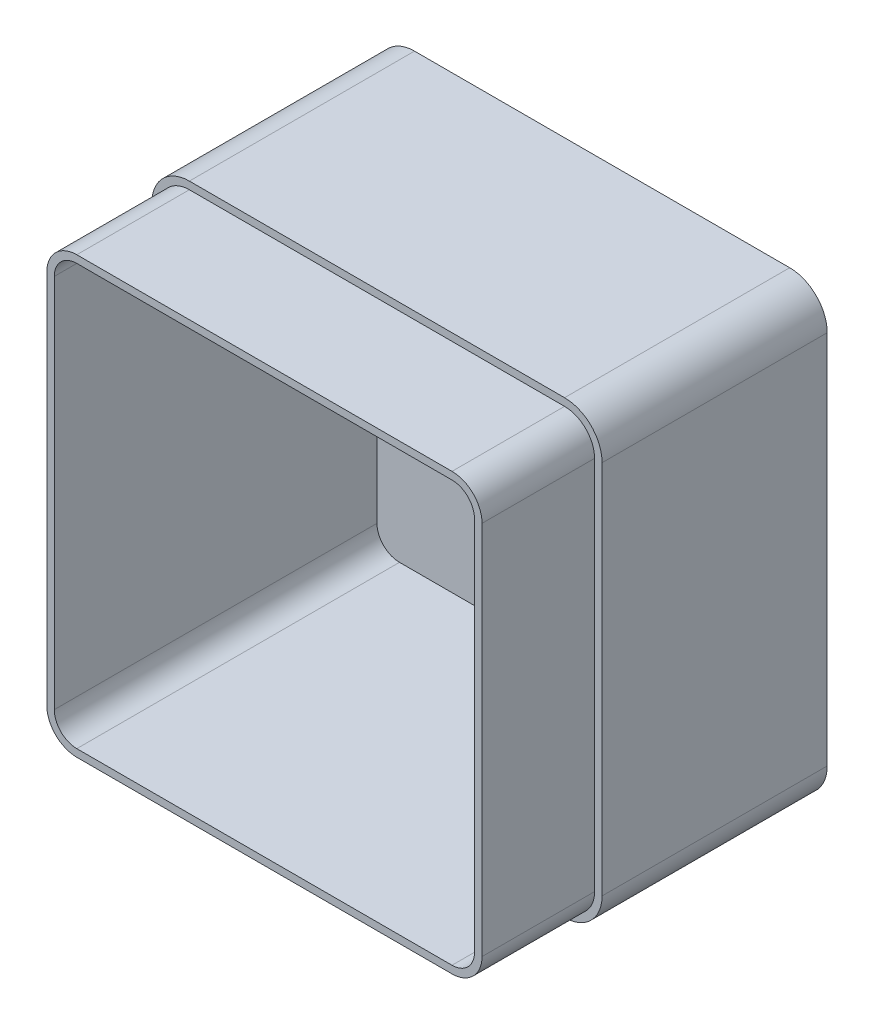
SolidWorks part; units mm, degrees
ref_plane "Front Plane" through (0, 0, 0) normal (0, 0, 1) x (1, 0, 0)
ref_plane "Top Plane" through (0, 0, 0) normal (0, 1, 0) x (1, 0, 0)
ref_plane "Right Plane" through (0, 0, 0) normal (1, 0, 0) x (0, 0, -1)
sketch "Sketch1" plane through (0, 0, 0) normal (0, 0, 1) x (1, 0, 0)
  line L1 (0, 0) -> (120, 0)
  line L2 (0, 0) -> (0, 120)
  line L3 (0, 120) -> (120, 120)
  line L4 (120, 0) -> (120, 120)
  dimension "D1" = 120
  dimension "D2" = 120
extrude "Extrude1" add sketch "Sketch1" along normal blind 90
fillet "Fillet1" radius 10 4 edges at (120, 0, 45) (120, 120, 45) (0, 120, 45) (0, 0, 45)
shell "Shell1" thickness 4
sketch "Sketch2" plane through (0, 0, 90) normal (0, 0, 1) x (1, 0, 0)
  line L4 (10, 0) -> (110, 0)
  line L5 (120, 10) -> (120, 110)
  line L6 (110, 120) -> (10, 120)
  line L7 (0, 110) -> (0, 10)
  line L8 (10, 0) -> (110, 0)
  line L9 (120, 10) -> (120, 110)
  line L10 (110, 120) -> (10, 120)
  line L11 (0, 110) -> (0, 10)
  line L16 (10, 2) -> (110, 2)
  line L17 (118, 10) -> (118, 110)
  line L18 (110, 118) -> (10, 118)
  line L19 (2, 110) -> (2, 10)
  line L20 (10, 2) -> (110, 2)
  line L21 (118, 10) -> (118, 110)
  line L22 (110, 118) -> (10, 118)
  line L23 (2, 110) -> (2, 10)
  arc A4 (110, 0) -> (120, 10) centre (110, 10) ccw
  arc A5 (120, 110) -> (110, 120) centre (110, 110) ccw
  arc A6 (10, 120) -> (0, 110) centre (10, 110) ccw
  arc A7 (0, 10) -> (10, 0) centre (10, 10) ccw
  arc A8 (110, 0) -> (120, 10) centre (110, 10) ccw
  arc A9 (120, 110) -> (110, 120) centre (110, 110) ccw
  arc A10 (10, 120) -> (0, 110) centre (10, 110) ccw
  arc A11 (0, 10) -> (10, 0) centre (10, 10) ccw
  arc A16 (110, 2) -> (118, 10) centre (110, 10) ccw
  arc A17 (118, 110) -> (110, 118) centre (110, 110) ccw
  arc A18 (10, 118) -> (2, 110) centre (10, 110) ccw
  arc A19 (2, 10) -> (10, 2) centre (10, 10) ccw
  arc A20 (110, 2) -> (118, 10) centre (110, 10) ccw
  arc A21 (118, 110) -> (110, 118) centre (110, 110) ccw
  arc A22 (10, 118) -> (2, 110) centre (10, 110) ccw
  arc A23 (2, 10) -> (10, 2) centre (10, 10) ccw
  dimension "D1" = 0
  dimension "D2" = 2
extrude "Cut-Extrude1" cut sketch "Sketch2" against normal blind 30
